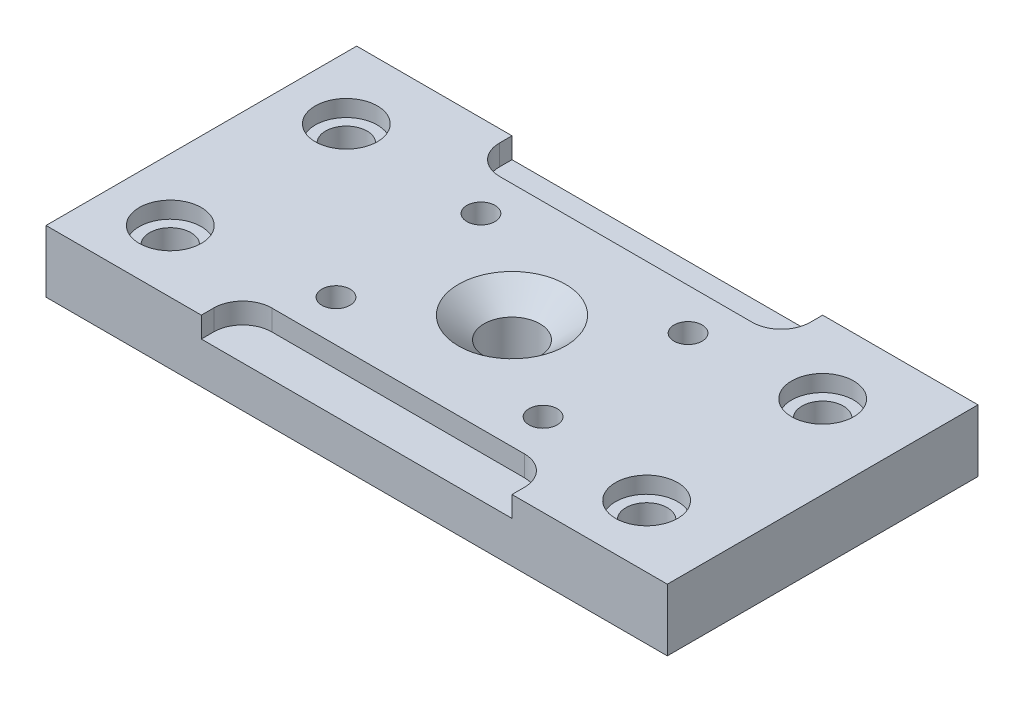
SolidWorks part; units mm, degrees
ref_plane "Front" through (0, 0, 0) normal (0, 0, 1) x (1, 0, 0)
ref_plane "Top" through (0, 0, 0) normal (0, 1, 0) x (1, 0, 0)
ref_plane "Right" through (0, 0, 0) normal (1, 0, 0) x (0, 0, -1)
sketch "Sketch2" plane through (0, 0, 0) normal (0, 1, 0) x (1, 0, 0)
  line L0 (75, -37.5) -> (-75, 37.5) construction
  line L1 (-75, 37.5) -> (75, 37.5)
  line L2 (-75, 37.5) -> (-75, -37.5)
  line L3 (-75, -37.5) -> (75, -37.5)
  line L4 (75, 37.5) -> (75, -37.5)
  dimension "D1" = 75
  dimension "D2" = 150
extrude "Extrude1" add sketch "Sketch2" along normal blind 15
sketch "Sketch3" plane through (0, 15, 0) normal (0, 1, 0) x (-1, 0, 0)
  line L2 (-37.5, 37.5) -> (-37.5, 34.5)
  line L3 (75, 37.5) -> (-75, 37.5) construction
  line L4 (-80.4328, 0) -> (81.9946, 0) construction
  line L5 (-30.5, 27.5) -> (30.5, 27.5)
  line L6 (37.5, 37.5) -> (37.5, 34.5)
  line L7 (0, 44.7345) -> (0, -20.8612) construction
  line L8 (37.5, -37.5) -> (37.5, -34.5)
  line L9 (-30.5, -27.5) -> (30.5, -27.5)
  line L10 (-37.5, -37.5) -> (-37.5, -34.5)
  line L15 (-37.5, 37.5) -> (37.5, 37.5)
  line L16 (-37.5, -37.5) -> (37.5, -37.5)
  arc A0 (-30.5, 27.5) -> (-37.5, 34.5) centre (-30.5, 34.5) cw
  arc A1 (30.5, 27.5) -> (37.5, 34.5) centre (30.5, 34.5) ccw
  arc A2 (30.5, -27.5) -> (37.5, -34.5) centre (30.5, -34.5) cw
  arc A3 (-30.5, -27.5) -> (-37.5, -34.5) centre (-30.5, -34.5) ccw
  point P17 (0, 27.5)
  point P26 (0, -27.5)
  dimension "D1" = 7
  dimension "D3" = 75
  dimension "D2" = 55
extrude "Cut-Extrude2" cut sketch "Sketch3" against normal blind 5
hole_wizard "CSK for 1/2 Flat Head Machine Screw (100)1" positions "Sketch5" profile "Sketch4" countersink size "1/2" standard "Ansi Inch"
sketch "Sketch5" plane through (0, 15, 0) normal (0, 1, 0) x (-1, 0, 0)
  point P0 (0, 0)
sketch "Sketch4" plane through (0, 15, 0) normal (1, 0, 0) x (0, 0, 1)
  line L0 (0, 0) -> (0, 29.0535)
  line L1 (0, 29.0535) -> (6.7462, 25)
  line L2 (6.7462, 25) -> (6.7462, 5.177)
  line L3 (6.7462, 5.177) -> (12.9159, 0)
  line L5 (12.9159, 0) -> (0, 0)
  line L6 (-6.7462, 5.177) -> (-12.9159, 0) construction
  line L10 (0, 29.0535) -> (-6.7462, 25) construction
  line L11 (0, -6.35) -> (0, 107.95) construction
  dimension "Hole Dia." = 13.4925
  dimension "Hole Depth" = 25
  dimension "Near C'Sink Dia." = 25.8318
  dimension "Near C'Sink Angle" = 100
  dimension "Drill Angle" = 118
hole_wizard "CBORE for M8 SHCS1" positions "Sketch7" profile "Sketch6" counterbore size "M8" standard "Ansi Metric"
sketch "Sketch7" plane through (0, 15, 0) normal (0, 1, 0) x (-1, 0, 0)
  line L0 (75, -37.5) -> (75, 37.5) construction
  line L1 (75, 37.5) -> (37.5, 37.5) construction
  point P0 (60, 22.5)
  dimension "D1" = 15
  dimension "D2" = 15
sketch "Sketch6" plane through (-60, 15, 22.5) normal (1, 0, 0) x (0, 0, 1)
  line L0 (0, 0) -> (0, 43.0043)
  line L1 (0, 43.0043) -> (5, 40)
  line L2 (5, 40) -> (5, 4)
  line L3 (5, 4) -> (7.5, 4)
  line L4 (7.5, 4) -> (7.5, 0)
  line L5 (7.5, 0) -> (0, 0)
  line L10 (0, 43.0043) -> (-5, 40) construction
  line L11 (0, -6.35) -> (0, 107.95) construction
  dimension "Hole Dia." = 10
  dimension "Hole Depth" = 40
  dimension "C'Bore Dia." = 15
  dimension "C'Bore Depth" = 4
  dimension "Drill Angle" = 118
pattern_linear "LPattern1" count 2 spacing 42.5 along (0, 0, -1) count 2 spacing 115 along (1, 0, 0) of "CBORE for M8 SHCS1"
hole_wizard "M8x1.25 Tapped Hole1" positions "Sketch10" profile "Sketch9" tap size "M8x1.25" standard "Ansi Metric"
sketch "Sketch10" plane through (0, 15, 0) normal (0, 1, 0) x (-1, 0, 0)
  line L0 (-75, 37.5) -> (-75, -37.5) construction
  line L1 (-37.5, 37.5) -> (-75, 37.5) construction
  line L2 (25, -17.5) -> (-25, 17.5) construction
  point P0 (-25, 17.5)
  point P5 (25, 17.5)
  point P6 (25, -17.5)
  point P7 (-25, -17.5)
  dimension "D1" = 50
  dimension "D2" = 20
sketch "Sketch9" plane through (25, 15, 17.5) normal (1, 0, 0) x (0, 0, 1)
  line L0 (0, 0) -> (0, 15)
  line L1 (0, 15) -> (3.4, 15)
  line L2 (3.4, 15) -> (3.4, 0)
  line L5 (3.4, 0) -> (0, 0)
  line L11 (0, -6.35) -> (0, 107.95) construction
  dimension "Thru Tap Drill Dia." = 6.8
  dimension "Thru Tap Drill Depth" = 15
hole_wizard "3/4 Standard Leader Pin1" positions "Sketch12" profile "Sketch11" counterbore size "3/4" standard "DME Mold Bases"
sketch "Sketch12" plane through (0, 15, 0) normal (0, 1, 0) x (-1, 0, 0)
  point P0 (45.4946, 0.5409)
sketch "Sketch11" plane through (-45.4946, 15, 0.5409) normal (1, 0, 0) x (0, 0, 1)
  line L0 (0, 0) -> (0, 45.7614)
  line L1 (0, 45.7614) -> (9.5885, 40)
  line L2 (9.5885, 40) -> (9.5885, 4.7625)
  line L3 (9.5885, 4.7625) -> (12.7, 4.7625)
  line L4 (12.7, 4.7625) -> (12.7, 0)
  line L5 (12.7, 0) -> (0, 0)
  line L10 (0, 45.7614) -> (-9.5885, 40) construction
  line L11 (0, -6.35) -> (0, 107.95) construction
  dimension "Hole Dia." = 19.177
  dimension "Hole Depth" = 40
  dimension "C'Bore Dia." = 25.4
  dimension "C'Bore Depth" = 4.7625
  dimension "Drill Angle" = 118
